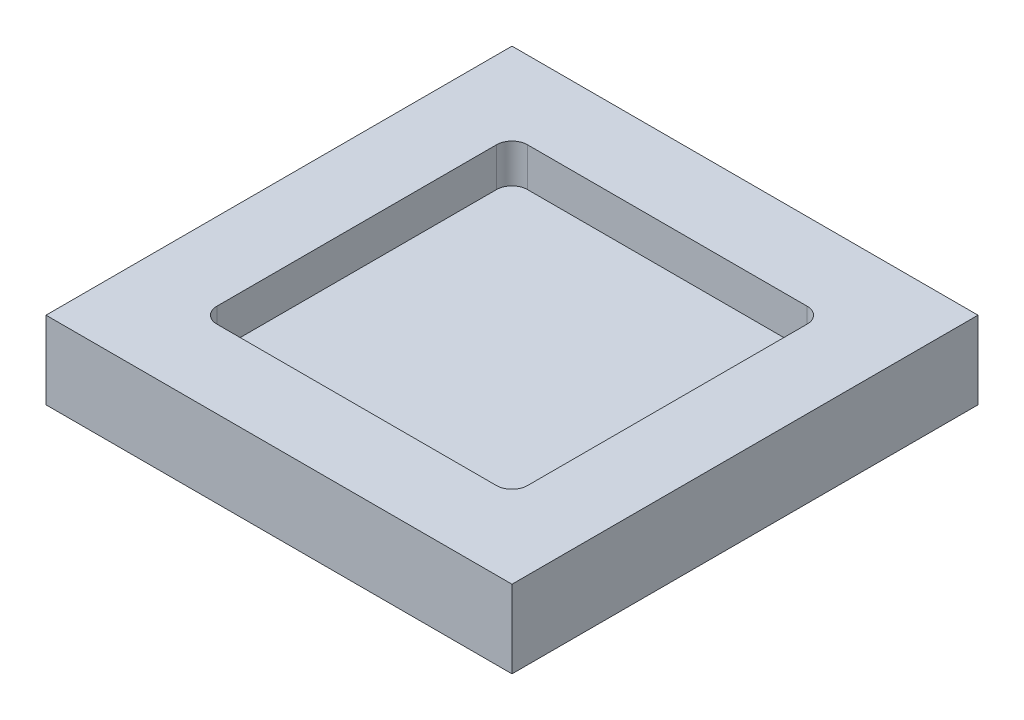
SolidWorks part; units mm, degrees
ref_plane "Front Plane" through (0, 0, 0) normal (0, 0, 1) x (1, 0, 0)
ref_plane "Top Plane" through (0, 0, 0) normal (0, 1, 0) x (1, 0, 0)
ref_plane "Right Plane" through (0, 0, 0) normal (1, 0, 0) x (0, 0, -1)
sketch "Sketch1" plane through (0, 0, 0) normal (0, 1, 0) x (1, 0, 0)
  line L0 (-38.1, -38.1) -> (38.1, 38.1) construction
  line L1 (-38.1, 38.1) -> (38.1, 38.1)
  line L2 (-38.1, 38.1) -> (-38.1, -38.1)
  line L3 (-38.1, -38.1) -> (38.1, -38.1)
  line L4 (38.1, 38.1) -> (38.1, -38.1)
  dimension "D1" = 76.2
  dimension "D2" = 76.2
extrude "Extrude1" add sketch "Sketch1" along normal blind 12.7
sketch "Sketch2" plane through (0, 12.7, 0) normal (0, 1, 0) x (-1, 0, 0)
  line L0 (25.4, 25.4) -> (-25.4, -25.4) construction
  line L1 (25.4, -25.4) -> (-25.4, -25.4)
  line L2 (25.4, -25.4) -> (25.4, 25.4)
  line L3 (25.4, 25.4) -> (-25.4, 25.4)
  line L4 (-25.4, -25.4) -> (-25.4, 25.4)
  dimension "D1" = 50.8
  dimension "D2" = 50.8
extrude "Cut-Extrude1" cut sketch "Sketch2" against normal blind 6.35
fillet "Fillet1" radius 2.54 4 edges at (-25.4, 9.525, 25.4) (-25.4, 9.525, -25.4) (25.4, 9.525, -25.4) (25.4, 9.525, 25.4)
